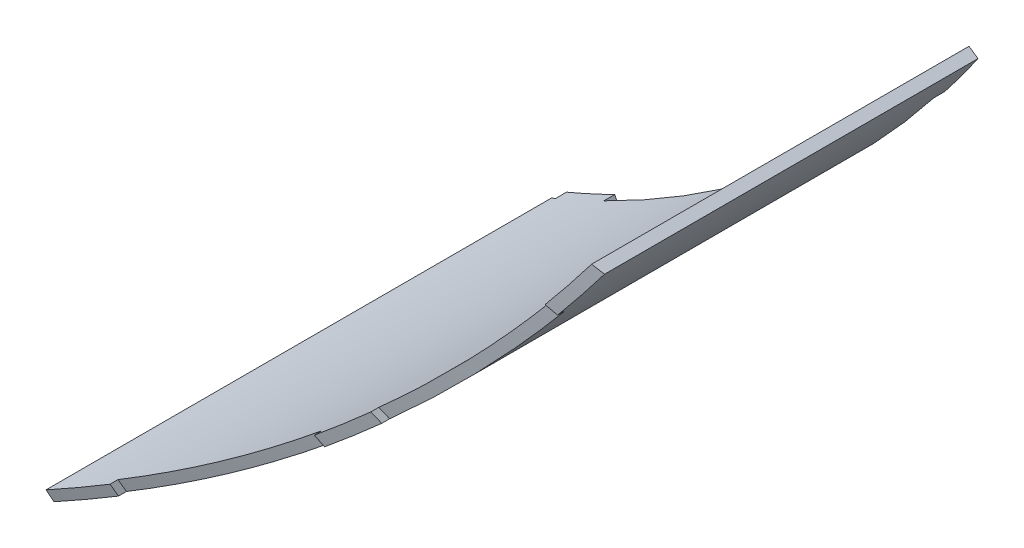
SolidWorks part; units mm, degrees
ref_plane "Płaszczyzna przednia" through (0, 0, 0) normal (0, 0, 1) x (1, 0, 0)
ref_plane "Płaszczyzna górna" through (0, 0, 0) normal (0, 1, 0) x (1, 0, 0)
ref_plane "Płaszczyzna prawa" through (0, 0, 0) normal (1, 0, 0) x (0, 0, -1)
sketch "Szkic1" plane through (0, 0, 0) normal (0, 0, 1) x (1, 0, 0)
  line L0 (706.1454, 127.1316) -> (704.9909, 129.9006)
  line L1 (819.3684, 218.8178) -> (816.9, 220.5227)
  arc A0 (704.9909, 129.9006) -> (816.9, 220.5227) centre (606.6695, 365.7265) ccw
  arc A1 (706.1454, 127.1316) -> (819.3684, 218.8178) centre (606.6695, 365.7265) ccw
extrude "Dodanie-wyciągnięcie1" add sketch "Szkic1" along normal up to surface (136.8969 mm away)
sketch "Szkic2" plane through (0, 0, 0) normal (0, 0, -1) x (-1, 0, 0)
  line L0 (-807.8699, 208.2483) -> (-810.2323, 206.3993)
  line L1 (-719.4131, 136.4454) -> (-720.7369, 133.7532)
  line L2 (-773.6001, 172.2966) -> (-775.489, 169.964)
  line L3 (-761.8295, 162.7331) -> (-763.6514, 160.3496)
  line L4 (-706.1454, 130.3852) -> (-707.3134, 127.6219)
  line L5 (-775.489, 169.964) -> (-773.6001, 172.2966) construction
  line L6 (-773.6001, 172.2966) -> (-775.489, 169.964)
  line L7 (-816.9, 220.5227) -> (-819.3684, 218.8178)
  arc A0 (-773.6001, 172.2966) -> (-761.8295, 162.7331) centre (-606.6695, 365.7265) ccw
  arc A1 (-775.489, 169.964) -> (-763.6514, 160.3496) centre (-606.6695, 365.7265) ccw
  arc A2 (-816.9, 220.5227) -> (-807.8699, 208.2483) centre (-606.6695, 365.7265) ccw
  arc A3 (-819.3684, 218.8178) -> (-810.2323, 206.3993) centre (-606.6695, 365.7265) ccw
  arc A4 (-719.4131, 136.4454) -> (-706.1454, 130.3852) centre (-606.6695, 365.7265) ccw
  arc A5 (-720.7369, 133.7532) -> (-707.3134, 127.6219) centre (-606.6695, 365.7265) ccw
extrude "Dodanie-wyciągnięcie2" add sketch "Szkic2" along normal up to surface (3 mm away) contours L0 M1 M2 M3 | L3 L2 M1 M3 | L4 L1 M1 M3
sketch "Szkic3" plane through (0, 0, 0) normal (0, 0, 1) x (1, 0, 0)
  line L0 (816.9, 220.5227) -> (819.3684, 218.8178)
  line L1 (807.8699, 208.2483) -> (810.2323, 206.3993)
  line L2 (819.3684, 218.8178) -> (816.9, 220.5227)
  line L3 (704.9909, 129.9006) -> (706.1454, 127.1316)
  line L4 (819.3684, 218.8178) -> (816.9, 220.5227)
  line L5 (704.9909, 129.9006) -> (706.1454, 127.1316)
  line L6 (772.9272, 171.7179) -> (774.8794, 169.4399)
  line L7 (761.2989, 162.3285) -> (763.1145, 159.9403)
  line L8 (704.9909, 129.9006) -> (706.1454, 127.1316)
  line L9 (718.5919, 136.0433) -> (719.906, 133.3465)
  arc A0 (816.9, 220.5227) -> (704.9909, 129.9006) centre (606.6695, 365.7265) cw
  arc A1 (819.3684, 218.8178) -> (706.1454, 127.1316) centre (606.6695, 365.7265) cw
  arc A2 (704.9909, 129.9006) -> (816.9, 220.5227) centre (606.6695, 365.7265) ccw
  arc A3 (706.1454, 127.1316) -> (819.3684, 218.8178) centre (606.6695, 365.7265) ccw
  arc A4 (704.9909, 129.9006) -> (816.9, 220.5227) centre (606.6695, 365.7265) ccw
  arc A5 (706.1454, 127.1316) -> (819.3684, 218.8178) centre (606.6695, 365.7265) ccw
  dimension "D1" = 0
sketch "Szkic4" plane through (0, 0, 0) normal (0, 0, 1) x (1, 0, 0)
  line L0 (704.9909, 129.9006) -> (706.1454, 127.1316) construction
  line L1 (718.5919, 136.0433) -> (719.906, 133.3465) construction
  line L2 (772.9272, 171.7179) -> (774.8794, 169.4399) construction
  line L3 (761.2989, 162.3285) -> (763.1145, 159.9403) construction
  line L4 (807.8699, 208.2483) -> (810.2323, 206.3993) construction
  line L5 (704.9909, 129.9006) -> (706.1454, 127.1316)
  line L6 (718.5919, 136.0433) -> (719.906, 133.3465)
  line L7 (772.9272, 171.7179) -> (774.8794, 169.4399)
  line L8 (761.2989, 162.3285) -> (763.1145, 159.9403)
  line L9 (807.8699, 208.2483) -> (810.2323, 206.3993)
  line L10 (816.9, 220.5227) -> (819.3684, 218.8178) construction
  line L11 (816.9, 220.5227) -> (819.3684, 218.8178)
  arc A0 (704.9909, 129.9006) -> (816.9, 220.5227) centre (606.6695, 365.7265) ccw construction
  arc A1 (706.1454, 127.1316) -> (819.3684, 218.8178) centre (606.6695, 365.7265) ccw construction
  arc A2 (704.9909, 129.9006) -> (718.5919, 136.0433) centre (606.6695, 365.7265) ccw
  arc A3 (706.1454, 127.1316) -> (719.906, 133.3465) centre (606.6695, 365.7265) ccw
  arc A4 (807.8699, 208.2483) -> (816.9, 220.5227) centre (606.6695, 365.7265) ccw
  arc A5 (810.2323, 206.3993) -> (819.3684, 218.8178) centre (606.6695, 365.7265) ccw
  arc A6 (761.2989, 162.3285) -> (772.9272, 171.7179) centre (606.6695, 365.7265) ccw
  arc A7 (763.1145, 159.9403) -> (774.8794, 169.4399) centre (606.6695, 365.7265) ccw
extrude "Dodanie-wyciągnięcie3" add sketch "Szkic4" along normal up to surface (139.0777 mm away)
